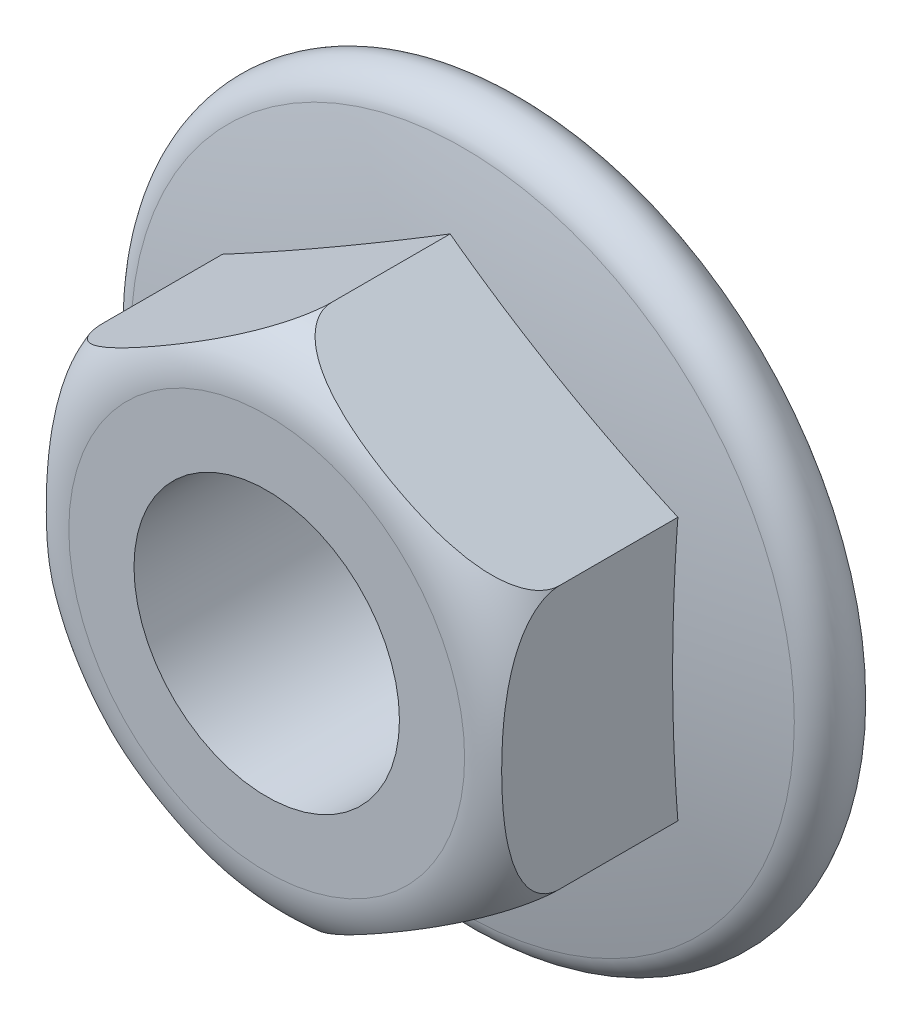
SolidWorks part; units mm, degrees
ref_plane "Plane1" through (0, 0, 0) normal (0, 0, 1) x (1, 0, 0)
ref_plane "Plane2" through (0, 0, 0) normal (0, 1, 0) x (-1, 0, 0)
ref_plane "Plane3" through (0, 0, 0) normal (1, 0, 0) x (0, 0, -1)
sketch "Head Sketch" plane through (0, 0, 0) normal (0, 0, 1) x (1, 0, 0)
  line L0 (0, 4.0415) -> (3.5, 2.0207)
  line L1 (3.5, 2.0207) -> (3.5, -2.0207)
  line L2 (3.5, -2.0207) -> (0, -4.0415)
  line L3 (0, -4.0415) -> (-3.5, -2.0207)
  line L4 (-3.5, -2.0207) -> (-3.5, 2.0207)
  line L5 (-3.5, 2.0207) -> (0, 4.0415)
  line L6 (3.5, 2.0207) -> (-3.5, -2.0207) construction
  line L7 (0, 4.0415) -> (0, -4.0415) construction
  line L8 (-3.5, 2.0207) -> (3.5, -2.0207) construction
  point P0 (0, 0)
  dimension "D1" = 60
  dimension "D2" = 60
  dimension "Flats" = 7
extrude "Head" add sketch "Head Sketch" along normal blind 4
sketch "Flange Sketch" plane through (0, 0, 0) normal (0, 1, 0) x (-1, 0, 0)
  line L0 (0, 1.8434) -> (0, 1.5) construction
  line L1 (-5, 0) -> (0, 0)
  line L2 (0, 50) -> (0, -50) construction
  line L4 (0, 0) -> (0, 1.5)
  line L5 (0, 0) -> (-3.5, 0) construction
  arc A0 (0, 1.5) -> (-5.099, 0.9901) centre (0, -24.25) ccw
  arc A1 (-5, 0) -> (-5.099, 0.9901) centre (-5, 0.5) cw
  dimension "D1" = 0.5
  dimension "D3" = 10
  dimension "Flange Height" = 1.5
revolve "Flange" add sketch "Flange Sketch" angle 360 about L0
sketch "Sketch5" plane through (0, 0, 0) normal (1, 0, 0) x (0, 0, -1)
  line L0 (-4, -3.0415) -> (-4, -4.0415)
  line L1 (-4, -4.0415) -> (-3, -4.0415)
  line L2 (-4, -4.0415) -> (-1.1809, -4.0415) construction
  line L3 (-4, -4.0415) -> (-4, -2.0207) construction
  line L5 (-15.0856, 0) -> (-8.1394, 0) construction
  line L6 (50, 0) -> (-50, 0) construction
  arc A0 (-4, -3.0415) -> (-3, -4.0415) centre (-3, -3.0415) ccw
  dimension "D1" = 1
revolve "Head Trim" cut sketch "Sketch5" angle 360 about L5
sketch "Hole Sketch" plane through (0, 0, 4) normal (0, 0, 1) x (1, 0, 0)
  line L0 (50, 0) -> (-50, 0) construction
  line L1 (0, -50) -> (0, 50) construction
  circle A0 centre (0, 0) radius 2.04
  dimension "Hole Dia" = 4.08
extrude "Through Hole" cut sketch "Hole Sketch" against normal through all
